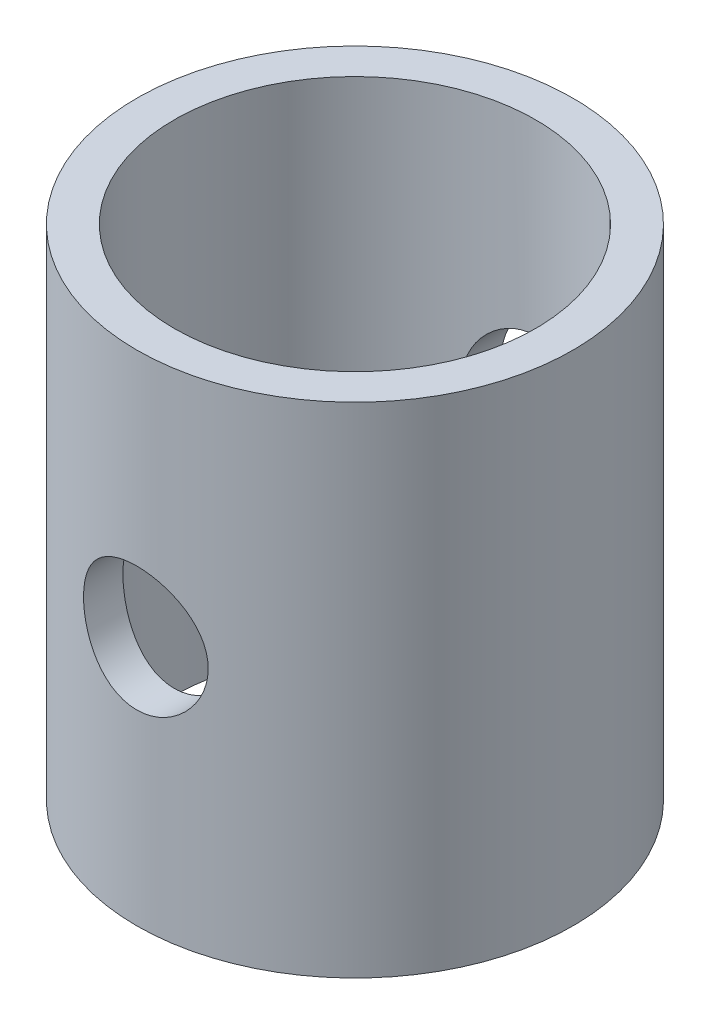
SolidWorks part; units mm, degrees
ref_plane "Front Plane" through (0, 0, 0) normal (0, 0, 1) x (1, 0, 0)
ref_plane "Top Plane" through (0, 0, 0) normal (0, 1, 0) x (1, 0, 0)
ref_plane "Right Plane" through (0, 0, 0) normal (1, 0, 0) x (0, 0, -1)
sketch "Sketch1" plane through (0, 0, 0) normal (0, 1, 0) x (1, 0, 0)
  circle A0 centre (0, 0) radius 17.5
  circle A1 centre (0, 0) radius 14.5
  dimension "D1" = 35
  dimension "D2" = 3
extrude "Extrude1" add sketch "Sketch1" along normal mid plane 40
sketch "Sketch2" plane through (0, 0, 0) normal (0, 0, 1) x (1, 0, 0)
  circle A0 centre (0, 0) radius 5
  dimension "D1" = 10
extrude "Cut-Extrude1" cut sketch "Sketch2" against normal mid plane 40
